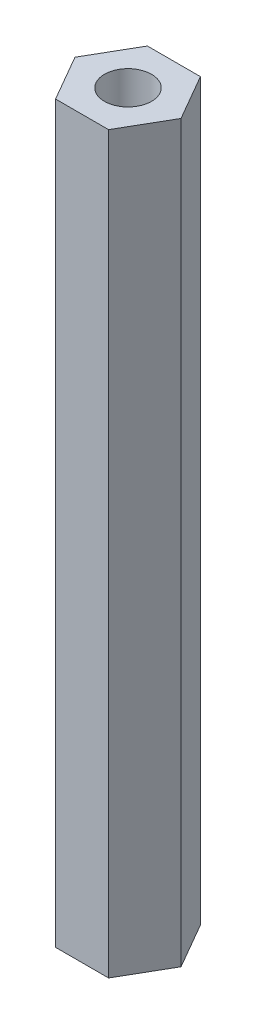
SolidWorks part; units mm, degrees
ref_plane "Front Plane" through (0, 0, 0) normal (0, 0, 1) x (1, 0, 0)
ref_plane "Top Plane" through (0, 0, 0) normal (0, 1, 0) x (1, 0, 0)
ref_plane "Right Plane" through (0, 0, 0) normal (1, 0, 0) x (0, 0, -1)
sketch "Sketch1" plane through (0, 0, 0) normal (0, 1, 0) x (1, 0, 0)
  line L1 (1.8331, 3.175) -> (-1.8331, 3.175)
  line L2 (-1.8331, 3.175) -> (-3.6662, 0)
  line L3 (-3.6662, 0) -> (-1.8331, -3.175)
  line L4 (-1.8331, -3.175) -> (1.8331, -3.175)
  line L5 (1.8331, -3.175) -> (3.6662, 0)
  line L6 (3.6662, 0) -> (1.8331, 3.175)
  circle A0 centre (0, 0) radius 3.175 construction
  circle A1 centre (0, 0) radius 1.6256
  dimension "D2" = 3.2512
  dimension "D1" = 6.35
extrude "Boss-Extrude1" add sketch "Sketch1" along normal blind 50.8
